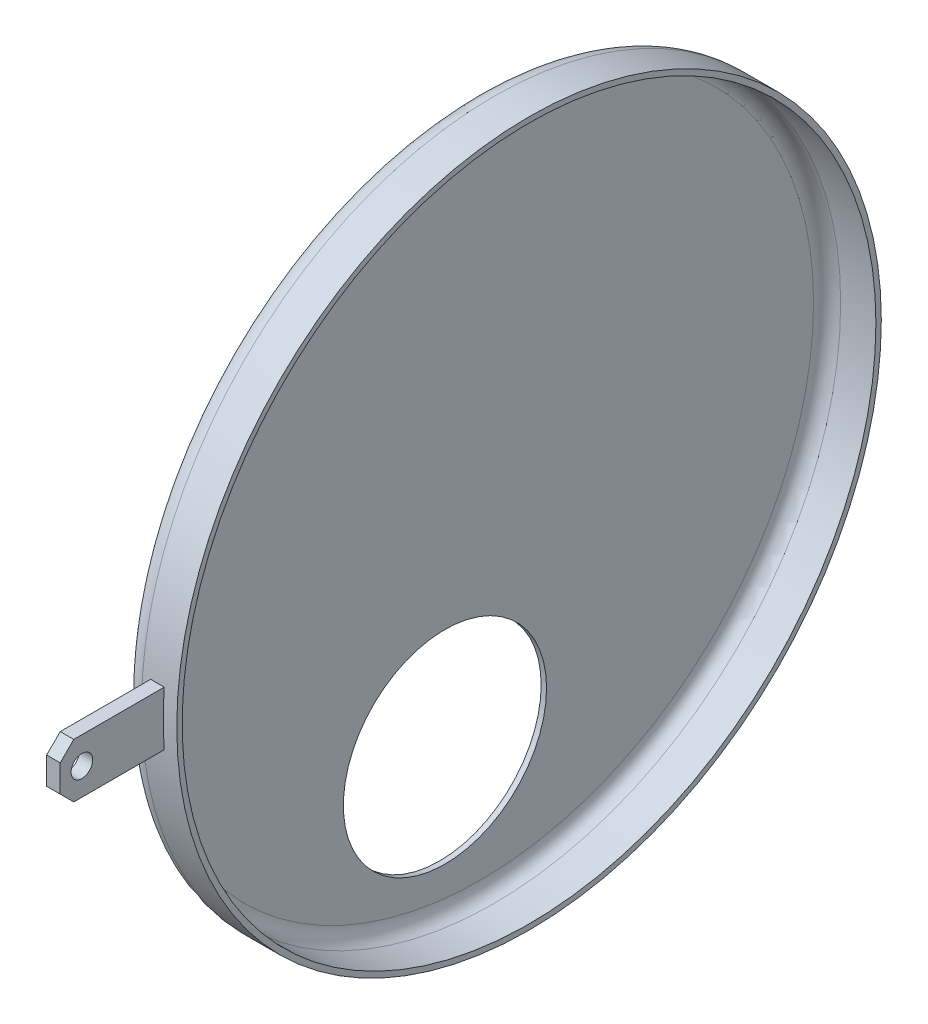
SolidWorks part; units mm, degrees
ref_plane "Plan 1" through (0, 0, 0) normal (0, 0, 1) x (1, 0, 0)
ref_plane "Plan 2" through (0, 0, 0) normal (0, 1, 0) x (1, 0, 0)
ref_plane "Plan 3" through (0, 0, 0) normal (1, 0, 0) x (0, 0, -1)
sketch "Esquisse1" plane through (0, 0, 0) normal (0, 0, 1) x (1, 0, 0)
  line L0 (0, 0) -> (52, 0)
  line L1 (0, 0) -> (0, 10)
  line L2 (0, 10) -> (50, 10)
  line L5 (50, 10) -> (50, 123)
  line L6 (57, 130) -> (70, 130)
  line L7 (70, 130) -> (70, 128)
  line L8 (70, 128) -> (57, 128)
  line L9 (52, 123) -> (52, 0)
  line L10 (52, 0) -> (0, 0) construction
  arc A0 (57, 130) -> (50, 123) centre (57, 123) ccw
  arc A1 (57, 128) -> (52, 123) centre (57, 123) ccw
  point P18 (50, 130)
  dimension "D8" = 7
  dimension "D9" = 5
  dimension "D2" = 50
  dimension "D3" = 20
  dimension "D4" = 10
  dimension "D6" = 130
  dimension "D7" = 2
  dimension "D10" = 2
revolve "Base-Révolution" add sketch "Esquisse1" angle 360 about L10
sketch "Esquisse3" plane through (52, 0, 0) normal (1, 0, 0) x (0, 0, -1)
  line L0 (0, 0) -> (0, -101) construction
  line L1 (0, 0) -> (0, 100) construction
  line L2 (0, 0) -> (-33.4895, -189.9283) construction
  circle A0 centre (0, 0) radius 75 construction
  circle A1 centre (-13.0236, -73.8606) radius 37.5
  dimension "D1" = 150
  dimension "D2" = 10
  dimension "D3" = 75
extrude "Enlèv. mat.-Extru.1" cut sketch "Esquisse3" against normal up to next
ref_plane "Plan1" through (0, 0, 168) normal (0, 0, 1) x (1, 0, 0)
sketch "Esquisse4" plane through (0, 0, 168) normal (0, 0, 1) x (1, 0, 0)
  line L0 (37, 0) -> (132, 0) construction
  line L1 (52, 0) -> (0, 0) construction
  line L3 (60, 10) -> (60, -10)
  line L4 (60, 10) -> (65, 10)
  line L5 (60, -10) -> (65, -10)
  line L6 (65, 10) -> (65, -10)
  line L8 (70, -130) -> (70, 130) construction
  dimension "D1" = 5
  dimension "D2" = 20
  dimension "D3" = 5
extrude "Boss.-Extru.1" add sketch "Esquisse4" against normal up to surface (38.3852 mm away)
sketch "Esquisse5" plane through (65, 0, 0) normal (1, 0, 0) x (0, 0, -1)
  line L0 (0, 0) -> (-205, 0) construction
  circle A0 centre (-160, 0) radius 4
  circle A1 centre (0, 0) radius 128 construction
  dimension "D1" = 8
  dimension "D2" = 160
extrude "Enlèv. mat.-Extru.2" cut sketch "Esquisse5" against normal through all
chamfer "Chanfrein1" distance 5 angle 45 2 edges at (62.5, 10, 168) (62.5, -10, 168)
sketch "Esq_WRNL_Compact001" plane through (0, 0, 0) normal (0, 0, 1) x (1, 0, 0)
  line L0 (-1, -131) -> (-1, 131)
  line L1 (71, -131) -> (71, 131)
  line L2 (-1, -131) -> (71, -131)
  line L3 (-1, 131) -> (71, 131)
ref_plane "Plan2" through (19, 0, 0) normal (-1, 0, 0) x (0, 0, 1)
sketch "POINT ROTULE" plane through (19, 0, 0) normal (-1, 0, 0) x (0, 0, 1)
  point P0 (0, 0)
  point P1 (-164.4005, 142.0455)
